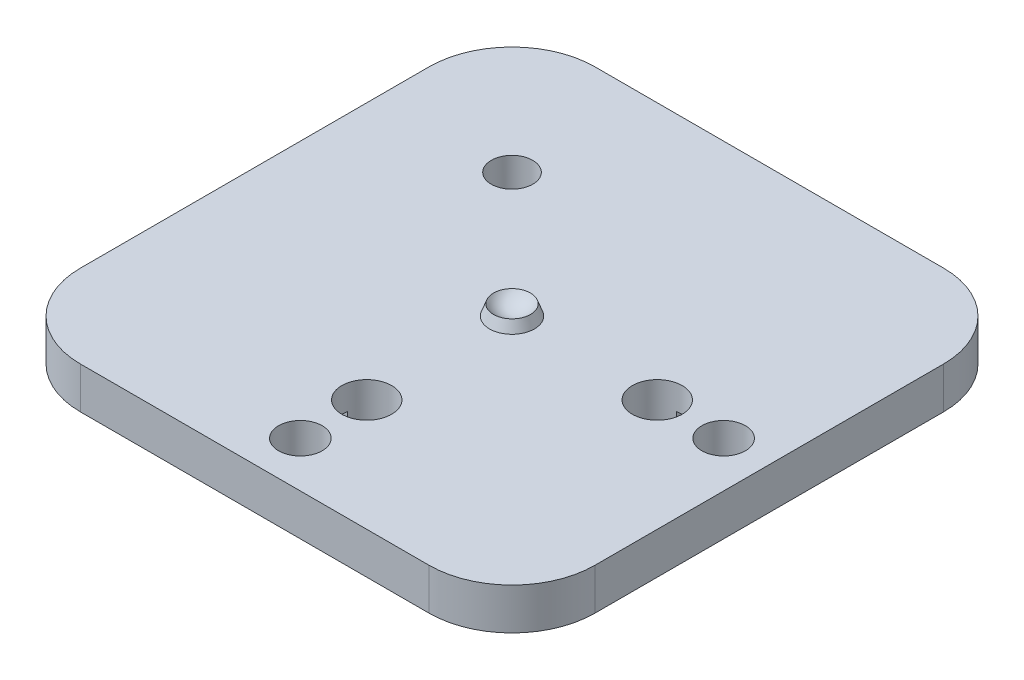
SolidWorks part; units mm, degrees
ref_plane "Front Plane" through (0, 0, 0) normal (0, 0, 1) x (1, 0, 0)
ref_plane "Top Plane" through (0, 0, 0) normal (0, 1, 0) x (1, 0, 0)
ref_plane "Right Plane" through (0, 0, 0) normal (1, 0, 0) x (0, 0, -1)
sketch "Sketch3" plane through (0, 0, 0) normal (0, 0, 1) x (1, 0, 0)
  line L3 (0, 0) -> (2.7, 0)
  line L4 (0, 0) -> (0, 2.8) construction
  line L5 (2.2332, 1.2825) -> (2.7, 0)
  line L6 (0, 0.1) -> (0, 0)
  arc A1 (0, 0.1) -> (2.2332, 1.2825) centre (0, 2.8) ccw
  dimension "D2" = 2.7
  dimension "D1" = 0.1
  dimension "D4" = 2.7
  dimension "D3" = 70
revolve "Revolve1" add sketch "Sketch3" angle 360 about L6
sketch "Sketch4" plane through (0, 0, 0) normal (0, -1, 0) x (1, 0, 0)
  line L0 (0, 0) -> (-31, 0) construction
  line L1 (-31, -31) -> (31, -31)
  line L2 (-31, -31) -> (-31, 31)
  line L3 (-31, 31) -> (31, 31)
  line L4 (31, -31) -> (31, 31)
  line L5 (-31, -31) -> (31, 31) construction
  line L6 (-31, 31) -> (31, -31) construction
  line L7 (0, 17.5) -> (0, 0) construction
  line L8 (0, 0) -> (17.5, 0) construction
  line L9 (0, 0) -> (0, 31) construction
  line L10 (-15, -15) -> (0, -15) construction
  line L11 (-15, -15) -> (-15, 0) construction
  circle A0 centre (17.5, 0) radius 3
  circle A1 centre (0, 17.5) radius 3
  circle A2 centre (-15, -15) radius 2.5
  circle A3 centre (0, 25.5) radius 2.625
  circle A4 centre (25.5, 0) radius 2.625
  point P0 (0, 0)
  dimension "D3" = 6
  dimension "D4" = 5
  dimension "D6" = 5.25
  dimension "D1" = 31
  dimension "D2" = 17.5
  dimension "D5" = 15
  dimension "D7" = 8
  dimension "D8" = 8
extrude "Boss-Extrude2" add sketch "Sketch4" along normal blind 5
sketch "Sketch5" plane through (0, -5, 0) normal (0, -1, 0) x (1, 0, 0)
  line L0 (-5.2, 18.1) -> (5.2, 18.1)
  line L1 (5.2, 18.1) -> (5.2, 16.9)
  line L2 (5.2, 16.9) -> (-5.2, 16.9)
  line L3 (-5.2, 16.9) -> (-5.2, 18.1)
  line L4 (16.9, 5.2) -> (18.1, 5.2)
  line L5 (18.1, 5.2) -> (18.1, -5.2)
  line L6 (18.1, -5.2) -> (16.9, -5.2)
  line L7 (16.9, -5.2) -> (16.9, 5.2)
  line L8 (-18.2527, -10.8988) -> (-10.8988, -18.2527)
  line L9 (-10.8988, -18.2527) -> (-11.7473, -19.1012)
  line L10 (-11.7473, -19.1012) -> (-19.1012, -11.7473)
  line L11 (-19.1012, -11.7473) -> (-18.2527, -10.8988)
  line L12 (-15, -15) -> (-15.4243, -15.4243) construction
  line L13 (-15, -15) -> (-14.5757, -14.5757) construction
  line L14 (-15, -15) -> (-18.677, -11.323) construction
  line L15 (-15, -15) -> (-11.323, -18.677) construction
  line L16 (-31, 31) -> (-31, -31) construction
  point P0 (0, 17.5)
  point P1 (17.5, 0)
  point P3 (-15, -15)
  point P16 (5.2, 17.5)
  point P19 (-5.2, 17.5)
  point P20 (0, 18.1)
  point P21 (0, 16.9)
  point P22 (16.9, 0)
  point P23 (18.1, 0)
  point P24 (17.5, 5.2)
  point P25 (17.5, -5.2)
  dimension "D1" = 10.4
  dimension "D2" = 1.2
  dimension "D3" = 135
extrude "Cut-Extrude1" cut sketch "Sketch5" against normal blind 2
sketch "Contour for hex bolt precision screws - 2.1 mm cut extrude" [suppressed] plane through (0, 0, 0) normal (0, 1, 0) x (1, 0, 0)
  line L0 (31, -31) -> (-31, -31) construction
  line L1 (1.8475, -22.3) -> (-1.8475, -22.3)
  line L2 (-1.8475, -22.3) -> (-3.695, -25.5)
  line L3 (-3.695, -25.5) -> (-1.8475, -28.7)
  line L4 (-1.8475, -28.7) -> (1.8475, -28.7)
  line L5 (1.8475, -28.7) -> (3.695, -25.5)
  line L6 (3.695, -25.5) -> (1.8475, -22.3)
  line L7 (28.7, 1.8475) -> (25.5, 3.695)
  line L8 (25.5, 3.695) -> (22.3, 1.8475)
  line L9 (22.3, 1.8475) -> (22.3, -1.8475)
  line L10 (22.3, -1.8475) -> (25.5, -3.695)
  line L11 (25.5, -3.695) -> (28.7, -1.8475)
  line L12 (28.7, -1.8475) -> (28.7, 1.8475)
  line L13 (31, 31) -> (31, -31) construction
  circle A0 centre (0, -25.5) radius 3.2 construction
  circle A1 centre (25.5, 0) radius 3.2 construction
  dimension "D1" = 6.4
fillet "Fillet1" radius 10 4 edges at (-31, -2.5, -31) (31, -2.5, -31) (-31, -2.5, 31) (31, -2.5, 31)
